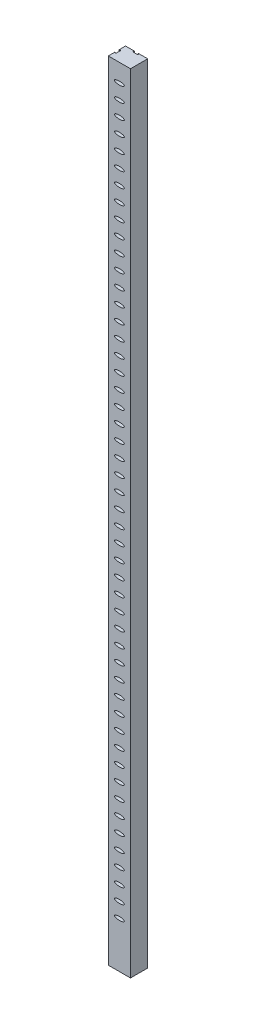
SolidWorks part; units mm, degrees
ref_plane "Plan de face" through (0, 0, 0) normal (0, 0, 1) x (1, 0, 0)
ref_plane "Plan de dessus" through (0, 0, 0) normal (0, 1, 0) x (1, 0, 0)
ref_plane "Plan de droite" through (0, 0, 0) normal (1, 0, 0) x (0, 0, -1)
sketch "Esquisse1" plane through (0, 0, 0) normal (0, 1, 0) x (1, 0, 0)
  line L0 (-22.5, 4) -> (-21.5, 4)
  line L1 (-22.5, -17.5) -> (22.5, -17.5)
  line L2 (-22.5, 4) -> (-22.5, 17.5)
  line L3 (-22.5, 17.5) -> (-4, 17.5)
  line L4 (22.5, -17.5) -> (22.5, 17.5)
  line L5 (-22.5, -17.5) -> (22.5, 17.5) construction
  line L6 (-22.5, 17.5) -> (22.5, -17.5) construction
  line L7 (-21.5, 4) -> (-21.5, 5)
  line L8 (-21.5, 5) -> (-20.5, 5)
  line L9 (-19.5, 4) -> (-19.5, -4)
  line L10 (-20.5, 5) -> (-19.5, 4)
  line L11 (-19.5, -4) -> (-20.5, -5)
  line L12 (-20.5, -5) -> (-21.5, -5)
  line L13 (-21.5, -5) -> (-21.5, -4)
  line L14 (-21.5, -4) -> (-22.5, -4)
  line L15 (-22.5, -4) -> (-22.5, -17.5)
  line L16 (-4, 17.5) -> (-4, 16.5)
  line L17 (-4, 16.5) -> (-5, 16.5)
  line L18 (-5, 16.5) -> (-5, 15.5)
  line L19 (-4, 14.5) -> (4, 14.5)
  line L20 (-5, 15.5) -> (-4, 14.5)
  line L21 (4, 14.5) -> (5, 15.5)
  line L22 (5, 15.5) -> (5, 16.5)
  line L23 (5, 16.5) -> (4, 16.5)
  line L24 (4, 16.5) -> (4, 17.5)
  line L25 (4, 17.5) -> (22.5, 17.5)
  point P0 (0, 0)
  dimension "D1" = 35
  dimension "D2" = 13.5
  dimension "D3" = 8
  dimension "D4" = 1
  dimension "D5" = 1
  dimension "D6" = 1
  dimension "D7" = 1
  dimension "D8" = 1
  dimension "D9" = 1
  dimension "D10" = 1
  dimension "D11" = 1
  dimension "D12" = 1
  dimension "D13" = 1
  dimension "D14" = 8
  dimension "D15" = 18.5
  dimension "D16" = 45
  dimension "D17" = 45
  dimension "D18" = 35
  dimension "D19" = 1
  dimension "D20" = 1
  dimension "D21" = 2
  dimension "D22" = 2
  dimension "D23" = 1.4142
  dimension "D24" = 1.4142
  dimension "D25" = 1.4142
extrude "Extrusion1" add sketch "Esquisse1" along normal blind 1600
sketch "Esquisse3" plane through (0, 0, 17.5) normal (0, 0, 1) x (1, 0, 0)
  line L0 (0, 1600) -> (0, 85) construction
  line L1 (-22.5, 1600) -> (22.5, 1600) construction
  line L2 (-22.5, 0) -> (22.5, 0) construction
  ellipse E0 centre (0, 1563.5) end of major axis (10, 1563.5) minor radius 3.5
  dimension "D1" = 85
  dimension "D2" = 40
  dimension "D3" = 7
  dimension "D4" = 20
extrude "Extrusion3" cut sketch "Esquisse3" against normal blind 10
pattern_linear "Répétition linéaire2" count 50 spacing 30 along (0, -1, 0) of "Extrusion3"
